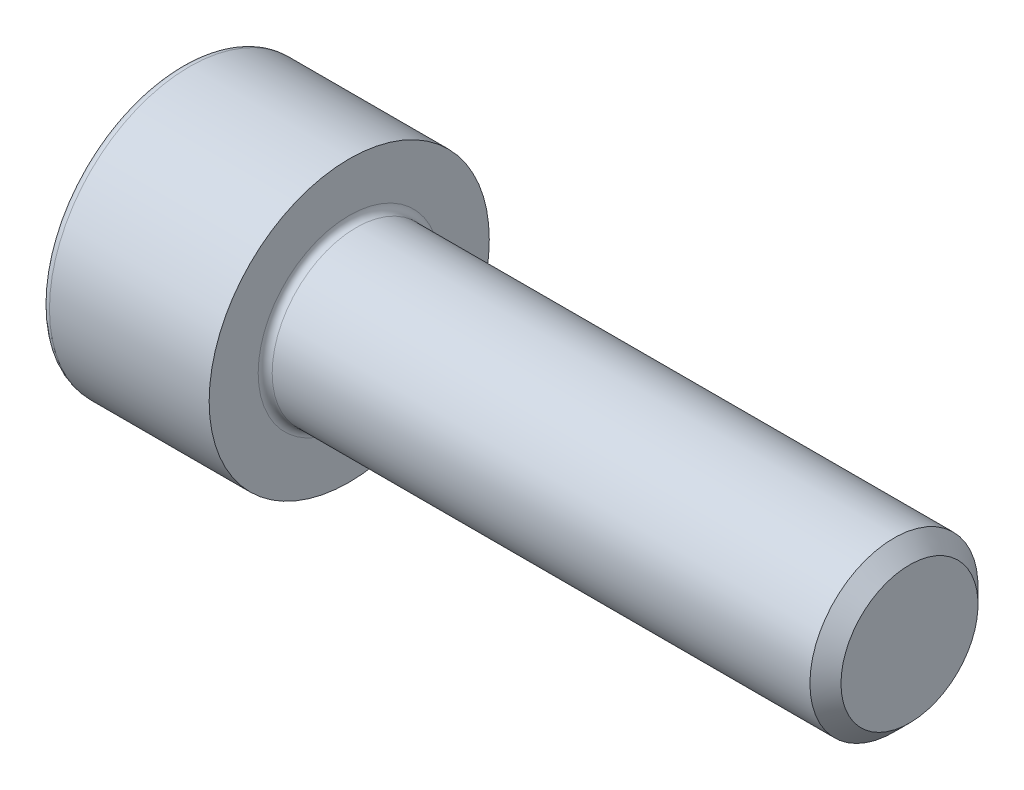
SolidWorks part; units mm, degrees
ref_plane "Plane1" through (0, 0, 0) normal (0, 0, 1) x (1, 0, 0)
ref_plane "Plane2" through (0, 0, 0) normal (0, 1, 0) x (1, 0, 0)
ref_plane "Plane3" through (0, 0, 0) normal (1, 0, 0) x (0, 0, -1)
sketch "BodySke" plane through (0, 0, 0) normal (0, 0, 1) x (1, 0, 0)
  line L0 (0, 0) -> (0, 5)
  line L1 (0, 5) -> (6, 5)
  line L2 (6, 5) -> (6, 3)
  line L3 (6, 3) -> (25.4455, 3)
  line L4 (26, 2.4455) -> (26, 0)
  line L5 (26, 0) -> (0, 0)
  line L6 (-31.75, 0) -> (127, 0) construction
  line L8 (26, 2.4455) -> (25.4455, 3)
  line L10 (26, -2.4455) -> (25.4455, -3) construction
  line L11 (7, 9.525) -> (7, 3.175) construction
  line L12 (6, 9.525) -> (6, 3.175) construction
  line L13 (-34, 9.525) -> (-34, 3.175) construction
  dimension "Diameter" = 6
  dimension "Head_ht" = 6
  dimension "Length" = 20
  dimension "Body_ch_ang" = 45
  dimension "Head_dia" = 10
  dimension "Minor_dia" = 4.891
  dimension "Advance" = 1
  dimension "Thread_nom" = 20
  dimension "Thread_length" = 60
revolve "Base-Revolve" add sketch "BodySke"
fillet "Fillet1" radius 0.25 1 edges at (6, 0, 3)
fillet "Fillet2" radius 0.3 1 edges at (0, 0, 5)
sketch "Sketch2" plane through (0, 0, 0) normal (0, 0, 1) x (1, 0, 0)
  line L0 (0, 2.542) -> (3, 2.542)
  line L1 (3, 2.542) -> (4.4676, 0)
  line L2 (-31.75, 0) -> (127, 0) construction
  line L3 (4.4676, 0) -> (0, 0)
  line L4 (0, 0) -> (0, 2.542)
  line L6 (0, 0) -> (47.625, 0) construction
  dimension "D1" = 2.542
  dimension "D2" = 60
  dimension "Depth" = 3
revolve "Hex-PreBroach" cut sketch "Sketch2" angle 360 about L6
sketch "Sketch3" plane through (0, 0, 0) normal (-1, 0, 0) x (0, 0.5, 0.866)
  line L0 (1.4676, 2.542) -> (-1.4676, 2.542)
  line L1 (-1.4676, 2.542) -> (-2.9352, 0)
  line L2 (1.4676, 2.542) -> (2.9352, 0)
  line L3 (1.4676, -2.542) -> (2.9352, 0)
  line L4 (1.4676, -2.542) -> (-1.4676, -2.542)
  line L5 (-1.4676, -2.542) -> (-2.9352, 0)
  dimension "D1" = 2.542
  dimension "D2" = 2.542
  dimension "Hex_size" = 5.084
extrude "Hex" cut sketch "Sketch3" against normal blind 3
sketch "ThdSchSke" plane through (0, 0, 0) normal (0, 0, 1) x (1, 0, 0)
  line L0 (9, -2.4455) -> (8.6117, -3)
  line L1 (9, -2.4455) -> (9.3883, -3)
  line L2 (9.3883, -3) -> (9.3883, -3.75)
  line L3 (-3.175, 0) -> (5.1513, 0) construction
  line L4 (0, 4.7) -> (0, -4.7) construction
  line L5 (9.3883, -3.75) -> (8.6117, -3.75)
  line L6 (8.6117, -3.75) -> (8.6117, -3)
  dimension "Thread_minor" = 4.891
  dimension "Diameter" = 6
  dimension "Start" = 9
  dimension "SideAngle" = 55
  dimension "VeeAngle" = 70
  dimension "Overcut" = 7.5
revolve "ThreadSchematic" [suppressed] cut sketch "ThdSchSke" angle 360 about L3
pattern_linear "ThdSchPat" [suppressed]
equation "\"D2@Sketch3\" = \"Hex_size@Sketch3\" / 2"
equation "\"D1@Sketch3\" = \"Hex_size@Sketch3\" / 2"
equation "\"D1@Sketch2\" = \"Hex_size@Sketch3\" / 2"
equation "\"Thread_minor@ThreadCosmetic\"  =  \"Minor_dia@BodySke\""
equation "\"Depth@Sketch2\" =  \"Key_eng@Hex\""
equation "\"Thread_length@ThreadCosmetic\" = ((sgn( (\"Length@BodySke\" - \"Advance@BodySke\" * 3.0) - \"Thread_nom@BodySke\" )-1)*( (\"Length@BodySke\" - \"Advance@BodySke\" * 3.0) - \"Thread_nom@BodySke\" ))/-2+ \"Thread_no"
equation "\"Thread_minor@ThdSchSke\" = \"Minor_dia@BodySke\""
equation "\"Diameter@ThdSchSke\" = \"Diameter@BodySke\""
equation "\"Overcut@ThdSchSke\" = \"Diameter@BodySke\" * 1.25"
equation "\"Start@ThdSchSke\" = \"Head_ht@BodySke\" + \"Length@BodySke\" - \"Thread_length@ThreadCosmetic\"  '---Non-countersunk---"
equation "\"Num_threads@ThdSchPat\" = int( \"Thread_length@ThreadCosmetic\" / \"Advance@BodySke\" + 0.999 )  + 1"
equation "\"Advance@ThdSchPat\" = \"Thread_length@ThreadCosmetic\" /  (\"Num_threads@ThdSchPat\" - 1) 'relax it"
equation "\"Num_threads@ThdSchPat\" = \"Num_threads@ThdSchPat\" - sgn( \"Num_threads@ThdSchPat\" - 1) '---chamfered tips only---"
